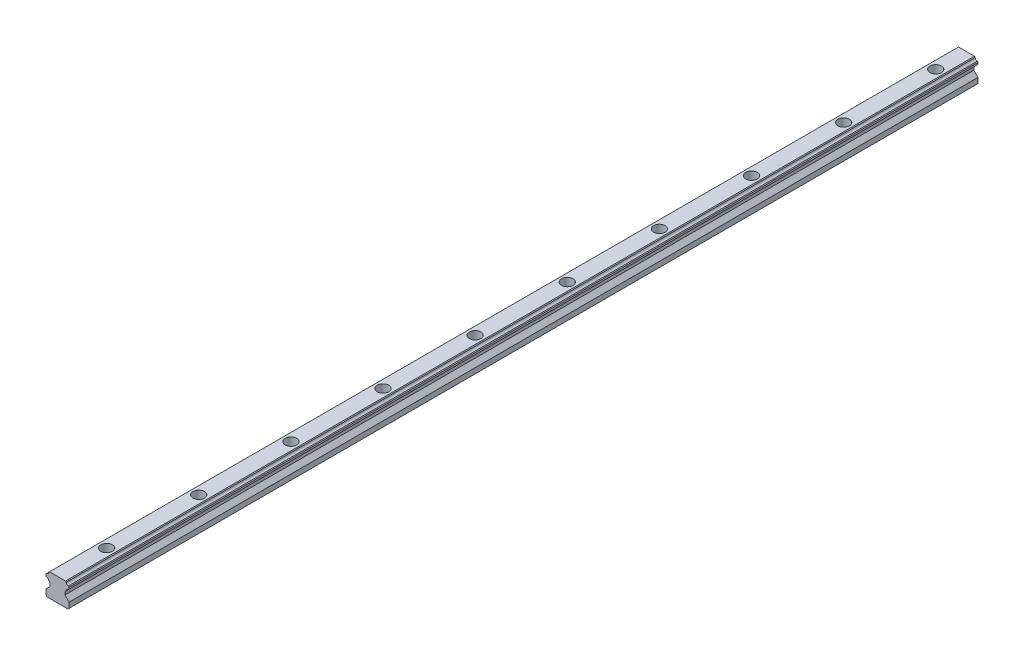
SolidWorks part; units mm, degrees
ref_plane "Спереди" through (0, 0, 0) normal (0, 0, 1) x (1, 0, 0)
ref_plane "Сверху" through (0, 0, 0) normal (0, 1, 0) x (1, 0, 0)
ref_plane "Справа" through (0, 0, 0) normal (1, 0, 0) x (0, 0, -1)
sketch "Эскиз1" plane through (0, 0, 0) normal (0, 0, 1) x (1, 0, 0)
  line L0 (2.4443, 15.0318) -> (12.8443, 15.0318)
  line L1 (0.1443, 4.2318) -> (2.8443, 6.9318)
  line L2 (0.1443, 4.2318) -> (0.1443, 0.7318)
  line L3 (0.8443, 0.0318) -> (14.4443, 0.0318)
  line L4 (2.8443, 8.8318) -> (2.8443, 6.9318)
  line L5 (13.3021, 9.6896) -> (12.4443, 8.8318)
  line L6 (15.1443, 4.2318) -> (12.4443, 6.9318)
  line L7 (15.1443, 4.2318) -> (15.1443, 0.7318)
  line L8 (12.4443, 8.8318) -> (12.4443, 6.9318)
  line L9 (1.9865, 9.6896) -> (2.8443, 8.8318)
  line L10 (0.1443, 12.7318) -> (0.1443, 11.5318)
  line L11 (0.1443, 11.5318) -> (0.6021, 11.074)
  line L12 (0.1443, 12.7318) -> (0.6021, 13.1896)
  line L13 (1.9865, 14.574) -> (2.4443, 15.0318)
  line L14 (15.1443, 11.5318) -> (14.6865, 11.074)
  line L15 (13.3021, 14.574) -> (12.8443, 15.0318)
  line L16 (15.1443, 12.7318) -> (14.6865, 13.1896)
  line L17 (15.1443, 12.7318) -> (15.1443, 11.5318)
  line L42 (0.1443, 0.7318) -> (0.8443, 0.0318)
  line L43 (15.1443, 0.7318) -> (14.4443, 0.0318)
  arc A0 (0.6021, 13.1896) -> (1.9865, 14.574) centre (0.3994, 14.7767) ccw
  arc A1 (1.9865, 9.6896) -> (0.6021, 11.074) centre (0.3994, 9.4869) ccw
  arc A2 (14.6865, 11.074) -> (13.3021, 9.6896) centre (14.8892, 9.4869) ccw
  arc A3 (13.3021, 14.574) -> (14.6865, 13.1896) centre (14.8892, 14.7767) ccw
extrude "Бобышка-Вытянуть1" add sketch "Эскиз1" along normal blind 592
hole_wizard "Цековка для винта с внутренним шестигранником M41" positions "Эскиз3" profile "Эскиз2" counterbore size "M4" standard "Ansi Metric"
sketch "Эскиз3" plane through (0, 15.0318, 0) normal (0, 1, 0) x (-1, 0, 0)
  line L1 (-15.1443, 592) -> (-15.1443, 0) construction
  line L2 (-0.8443, 0) -> (-14.4443, 0) construction
  point P0 (-7.6443, 20)
  point P63 (-7.6443, 80)
  point P64 (-7.6443, 140)
  point P65 (-7.6443, 200)
  point P66 (-7.6443, 260)
  point P67 (-7.6443, 320)
  point P68 (-7.6443, 380)
  point P69 (-7.6443, 440)
  point P70 (-7.6443, 500)
  point P71 (-7.6443, 560)
  point P72 (-7.6443, 620)
  point P73 (-7.6443, 680)
  point P77 (-7.6443, 740)
  point P78 (-7.6443, 800)
  point P79 (-7.6443, 860)
  point P80 (-7.6443, 920)
  point P81 (-7.6443, 980)
  point P82 (-7.6443, 1040)
  dimension "D1" = 18
  dimension "D3" = 60
  dimension "D7" = 7.5
  dimension "D20" = 20
sketch "Эскиз2" plane through (7.6443, 15.0318, 20) normal (1, 0, 0) x (0, 0, 1)
  line L0 (0, 0) -> (0, 15)
  line L1 (0, 15) -> (2.25, 15)
  line L3 (2.25, 15) -> (2.25, 5.3)
  line L4 (2.25, 5.3) -> (3.75, 5.3)
  line L5 (3.75, 5.3) -> (3.75, 0)
  line L7 (3.75, 0) -> (0, 0)
  line L11 (0, -6.35) -> (0, 107.95) construction
  dimension "Диаметр сквозного отверстия" = 4.5
  dimension "Глубина сквозного отверстия" = 15
  dimension "Диаметр цековки" = 7.5
  dimension "Глубина цековки" = 5.3
